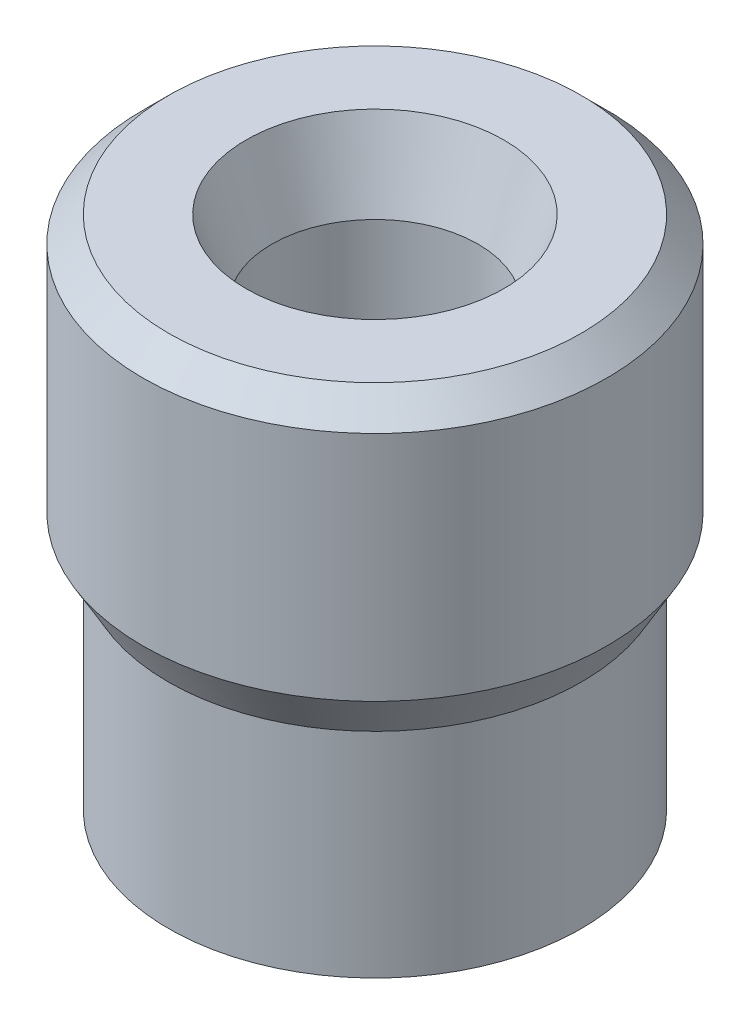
SolidWorks part; units mm, degrees
ref_plane "Přední rovina" through (0, 0, 0) normal (0, 0, 1) x (1, 0, 0)
ref_plane "Horní rovina" through (0, 0, 0) normal (0, 1, 0) x (1, 0, 0)
ref_plane "Pravá rovina" through (0, 0, 0) normal (1, 0, 0) x (0, 0, -1)
sketch "Skica1" plane through (0, 0, 0) normal (0, 1, 0) x (1, 0, 0)
  circle A0 centre (0, 0) radius 8
extrude "Přidat vysunutím1" add sketch "Skica1" along normal blind 8.3
sketch "Skica2" plane through (0, 8.3, 0) normal (0, 1, 0) x (-1, 0, 0)
  circle A0 centre (0, 0) radius 9
extrude "Přidat vysunutím2" add sketch "Skica2" along normal blind 11.7
chamfer "Zkosení1" distance 1.7 angle 30 1 edges at (0, 8.3, 9)
chamfer "Zkosení2" distance 1 angle 45 1 edges at (0, 20, 9)
sketch "Skica3" plane through (0, 0, 0) normal (0, -1, 0) x (1, 0, 0)
  circle A0 centre (0, 0) radius 3
extrude "Odebrat vysunutím1" cut sketch "Skica3" against normal blind 11
sketch "Skica4" plane through (0, 20, 0) normal (0, 1, 0) x (1, 0, 0)
  circle A0 centre (0, 0) radius 4
  dimension "D1" = 8
extrude "Odebrat vysunutím2" cut sketch "Skica4" against normal blind 9
chamfer "Zkosení3" distance 1 distance2 3 1 edges at (0, 20, 4)
